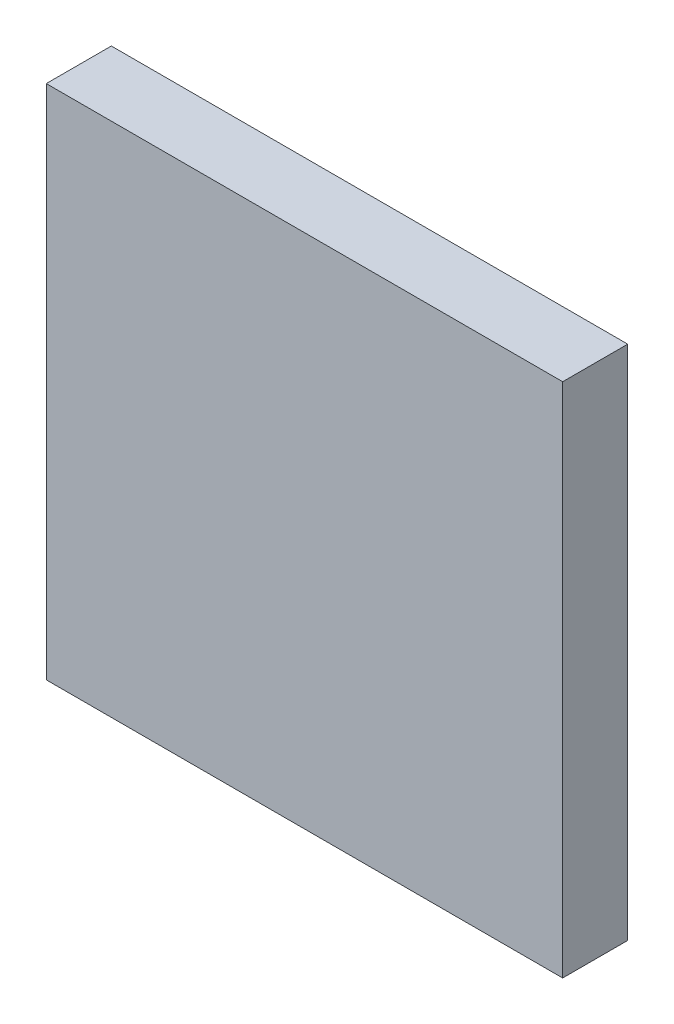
SolidWorks part; units mm, degrees
ref_plane "Front Plane" through (0, 0, 0) normal (0, 0, 1) x (1, 0, 0)
ref_plane "Top Plane" through (0, 0, 0) normal (0, 1, 0) x (1, 0, 0)
ref_plane "Right Plane" through (0, 0, 0) normal (1, 0, 0) x (0, 0, -1)
sketch "Sketch1" plane through (0, 0, 0) normal (0, 0, 1) x (1, 0, 0)
  line L1 (-25.4, 25.4) -> (0, 25.4)
  line L2 (-25.4, 25.4) -> (-25.4, 0)
  line L3 (-25.4, 0) -> (0, 0)
  line L4 (0, 25.4) -> (0, 0)
  dimension "D1" = 25.4
  dimension "D2" = 25.4
extrude "Extrude1" add sketch "Sketch1" along normal blind 3.2004
sketch "Sketch2" plane through (0, 0, 0) normal (0, 0, 1) x (1, 0, 0)
  line L1 (-21.4289, 20.4569) -> (-8.7289, 20.4569)
  line L2 (-21.4289, 20.4569) -> (-21.4289, 7.7569)
  line L3 (-21.4289, 7.7569) -> (-8.7289, 7.7569)
  line L4 (-8.7289, 20.4569) -> (-8.7289, 7.7569)
  dimension "D1" = 12.7
  dimension "D2" = 12.7
extrude "Cut-Extrude2" cut sketch "Sketch2" along normal through all flip side to cut
sketch "Sketch4" plane through (0, 0, 3.2004) normal (0, 0, 1) x (1, 0, 0)
  line L0 (-8.7289, 20.4569) -> (-21.4289, 20.4569) construction
  point P0 (-15.0789, 20.4569)
